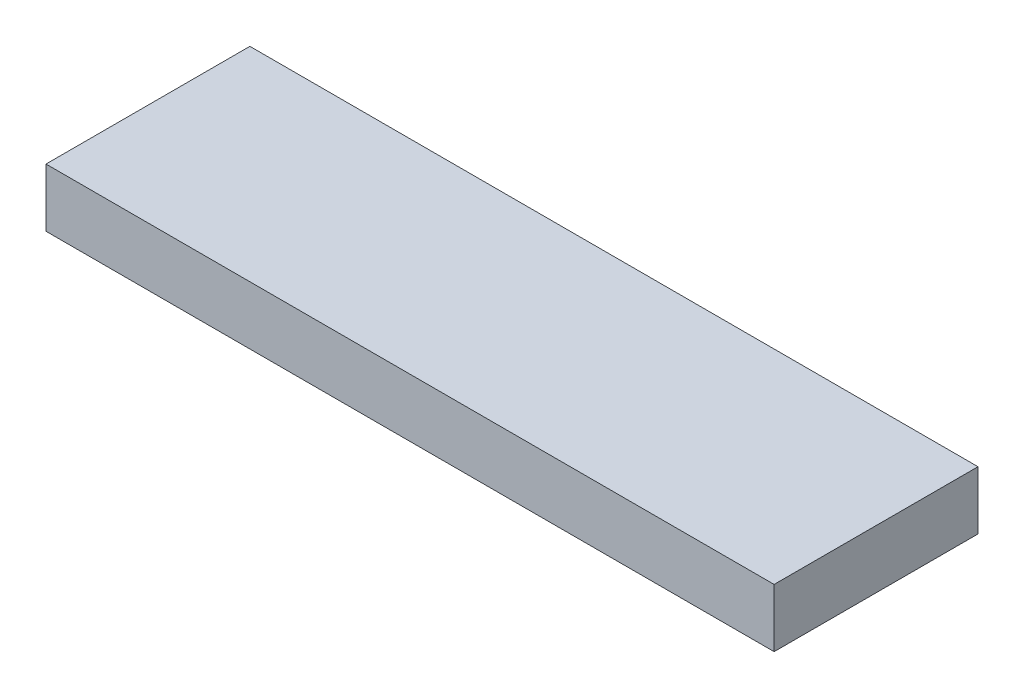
SolidWorks part; units mm, degrees
ref_plane "Plan de face" through (0, 0, 0) normal (0, 0, 1) x (1, 0, 0)
ref_plane "Plan de dessus" through (0, 0, 0) normal (0, 1, 0) x (1, 0, 0)
ref_plane "Plan de droite" through (0, 0, 0) normal (1, 0, 0) x (0, 0, -1)
sketch "Esquisse1" plane through (0, 0, 0) normal (0, 0, 1) x (1, 0, 0)
  line L1 (0, 0) -> (250, 0)
  line L2 (0, 0) -> (0, -20)
  line L3 (0, -20) -> (250, -20)
  line L4 (250, 0) -> (250, -20)
  dimension "D1" = 20
  dimension "D2" = 250
extrude "Extrusion1" add sketch "Esquisse1" along normal mid plane 70
